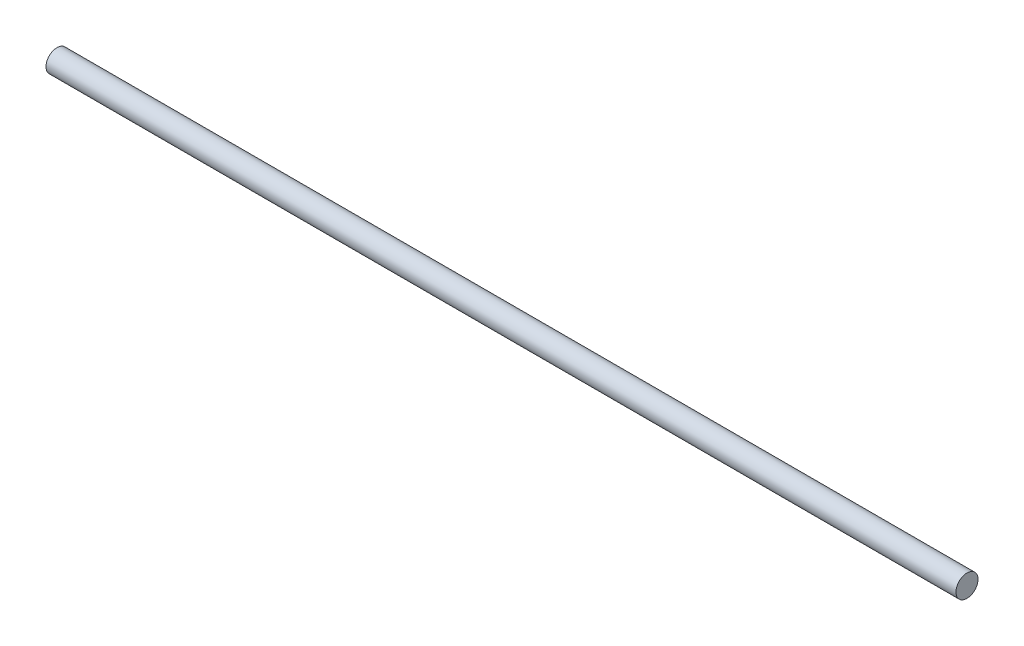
SolidWorks part; units mm, degrees
ref_plane "Front" through (0, 0, 0) normal (0, 0, 1) x (1, 0, 0)
ref_plane "Top" through (0, 0, 0) normal (0, 1, 0) x (1, 0, 0)
ref_plane "Right" through (0, 0, 0) normal (1, 0, 0) x (0, 0, -1)
sketch "Sketch1" plane through (0, 0, 0) normal (0, 0, 1) x (1, 0, 0)
  line L0 (0, 0) -> (-419.1, 0)
  line L1 (-419.1, 0) -> (-419.1, 5.08)
  line L2 (-419.1, 5.08) -> (0, 5.08)
  line L3 (0, 5.08) -> (0, 0)
  dimension "D1" = 419.1
  dimension "D2" = 5.08
revolve "Revolve1" add sketch "Sketch1" angle 360 about L0
